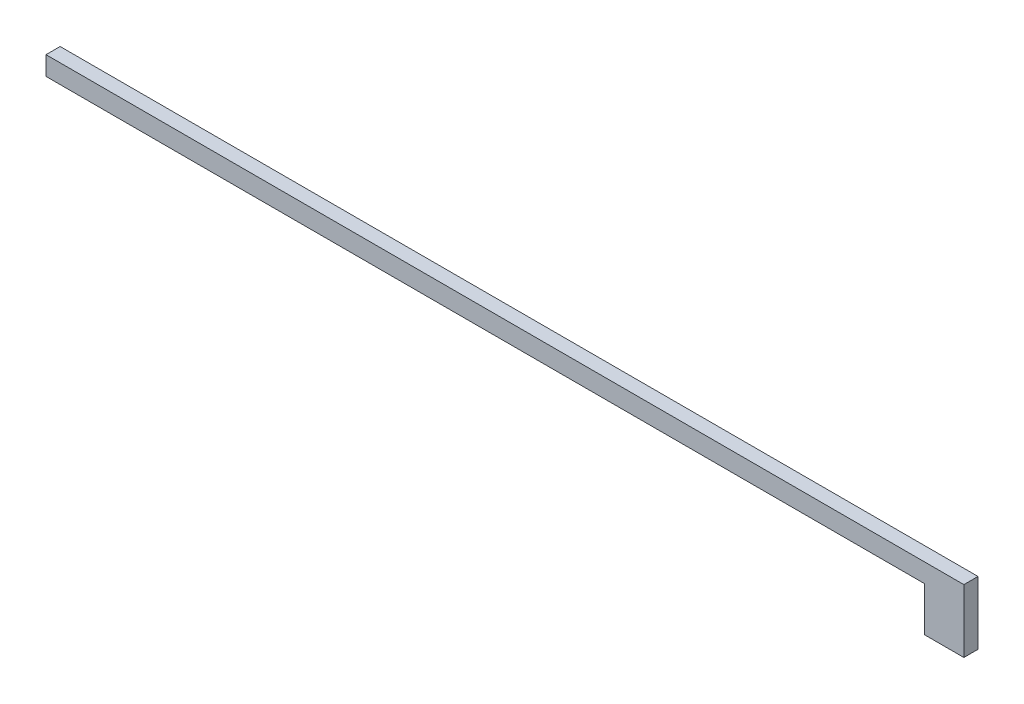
SolidWorks part; units mm, degrees
ref_plane "Front Plane" through (0, 0, 0) normal (0, 0, 1) x (1, 0, 0)
ref_plane "Top Plane" through (0, 0, 0) normal (0, 1, 0) x (1, 0, 0)
ref_plane "Right Plane" through (0, 0, 0) normal (1, 0, 0) x (0, 0, -1)
sketch "Sketch1" plane through (0, 0, 0) normal (0, 0, 1) x (1, 0, 0)
  line L0 (-122.6213, 19.3044) -> (114.1067, 19.3044)
  line L1 (-122.6213, 24.3844) -> (124.7747, 24.3844)
  line L2 (-122.6213, 24.3844) -> (-122.6213, 19.3044)
  line L3 (114.1067, 19.3044) -> (114.1067, 7.3664)
  line L4 (124.7747, 24.3844) -> (124.7747, 19.3044)
  line L5 (114.1067, 7.3664) -> (124.7747, 7.3664)
  line L6 (124.7747, 7.3664) -> (124.7747, 19.3044)
  dimension "D1" = 236.728
  dimension "D2" = 247.396
  dimension "D3" = 11.938
extrude "Extrude1" add sketch "Sketch1" along normal blind 3.81
